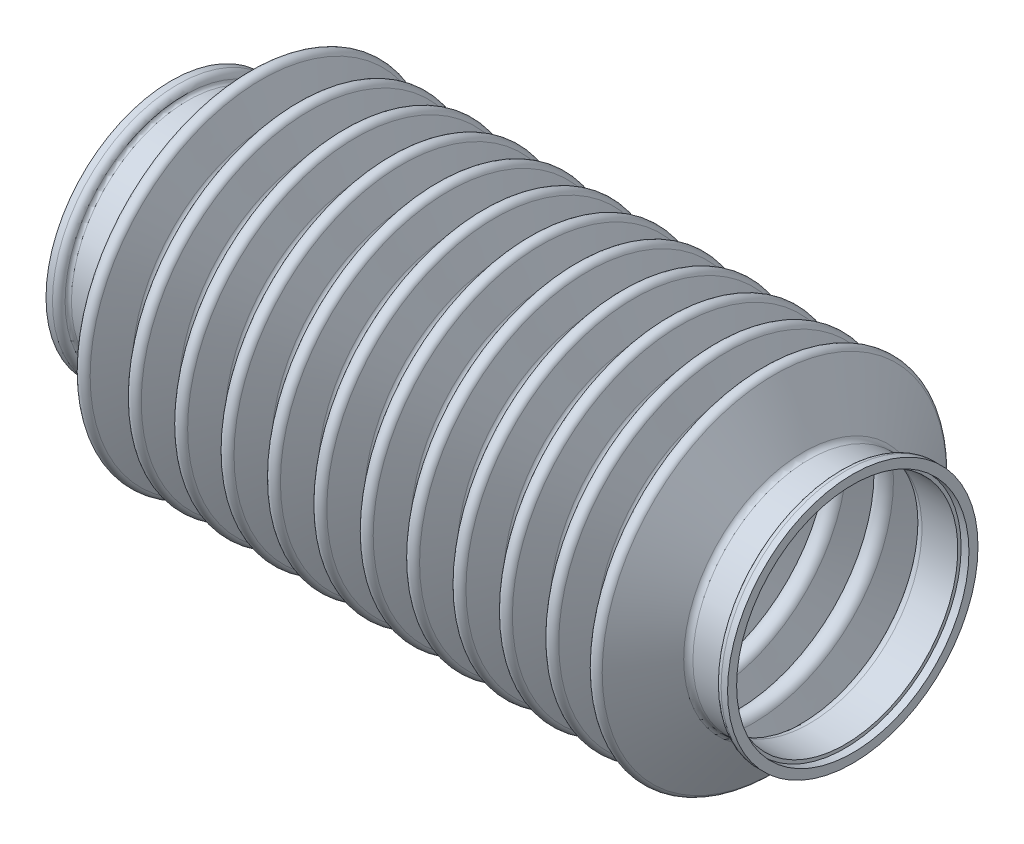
SolidWorks part; units mm, degrees
ref_plane "Alzado" through (0, 0, 0) normal (0, 0, 1) x (1, 0, 0)
ref_plane "Planta" through (0, 0, 0) normal (0, 1, 0) x (1, 0, 0)
ref_plane "Vista lateral" through (0, 0, 0) normal (1, 0, 0) x (0, 0, -1)
sketch "Croquis1" plane through (0, 0, 0) normal (0, 0, 1) x (1, 0, 0)
  line L0 (-66.1214, 37.7921) -> (-66.1214, 35.0586)
  line L1 (-62.1717, 0) -> (100.9562, 0) construction
  line L2 (-61.1836, 35.0586) -> (-52.9347, 35.0586)
  line L3 (-51.1833, 36.0929) -> (-42.4423, 51.9452)
  line L4 (-38.8423, 51.7426) -> (-35.1248, 42.7368)
  line L5 (-24.4274, 50.7375) -> (-21.1248, 42.7368)
  line L6 (-28.1248, 50.7375) -> (-31.4274, 42.7368)
  line L7 (-14.1248, 50.7375) -> (-17.4274, 42.7368)
  line L8 (-10.4274, 50.7375) -> (-7.1248, 42.7368)
  line L9 (-0.1248, 50.7375) -> (-3.4274, 42.7368)
  line L10 (3.5726, 50.7375) -> (6.8752, 42.7368)
  line L11 (13.8752, 50.7375) -> (10.5726, 42.7368)
  line L12 (17.5726, 50.7375) -> (20.8752, 42.7368)
  line L13 (27.8752, 50.7375) -> (24.5726, 42.7368)
  line L14 (31.5726, 50.7375) -> (34.8752, 42.7368)
  line L15 (-64.1717, 37.7921) -> (-66.1214, 37.7921)
  line L16 (-61.1836, 34.0586) -> (-52.9347, 34.0586)
  line L17 (-50.3076, 35.6101) -> (-41.5666, 51.4623)
  line L18 (43.5686, 55.5922) -> (50.7239, 38.2584)
  line L19 (57.8792, 55.5922) -> (50.7239, 38.2584)
  line L20 (43.8792, 55.5922) -> (38.5726, 42.7368)
  line L21 (-39.7666, 51.361) -> (-36.0491, 42.3553)
  line L22 (-27.2004, 50.356) -> (-30.503, 42.3553)
  line L23 (-25.3517, 50.356) -> (-22.0491, 42.3553)
  line L24 (-13.2004, 50.356) -> (-16.503, 42.3553)
  line L25 (-11.3517, 50.356) -> (-8.0491, 42.3553)
  line L26 (0.7996, 50.356) -> (-2.503, 42.3553)
  line L27 (2.6483, 50.356) -> (5.9509, 42.3553)
  line L28 (14.7996, 50.356) -> (11.497, 42.3553)
  line L29 (16.6483, 50.356) -> (19.9509, 42.3553)
  line L30 (28.7996, 50.356) -> (25.497, 42.3553)
  line L31 (30.6483, 50.356) -> (33.9509, 42.3553)
  line L32 (-64.1717, 36.7921) -> (-66.1214, 36.7921) construction
  line L33 (-66.1214, 35.0586) -> (-63.7677, 35.0586)
  line L34 (-63.7677, 35.0586) -> (-63.7677, 34.0586)
  line L35 (-63.7677, 34.0586) -> (-61.1836, 34.0586)
  line L36 (36.7239, 46.4242) -> (36.7239, 34.7599) construction
  line L37 (137.2155, 34.0586) -> (134.6315, 34.0586)
  line L38 (137.2155, 35.0586) -> (137.2155, 34.0586)
  line L39 (139.5692, 35.0586) -> (137.2155, 35.0586)
  line L40 (70.7996, 50.356) -> (67.497, 42.3553)
  line L41 (72.6483, 50.356) -> (75.9509, 42.3553)
  line L42 (84.7996, 50.356) -> (81.497, 42.3553)
  line L43 (86.6483, 50.356) -> (89.9509, 42.3553)
  line L44 (98.7996, 50.356) -> (95.497, 42.3553)
  line L45 (100.6483, 50.356) -> (103.9509, 42.3553)
  line L46 (113.2145, 51.361) -> (109.497, 42.3553)
  line L47 (123.7555, 35.6101) -> (115.0145, 51.4623)
  line L48 (134.6315, 34.0586) -> (126.3826, 34.0586)
  line L49 (137.6196, 37.7921) -> (139.5692, 37.7921)
  line L50 (69.8752, 50.7375) -> (66.5726, 42.7368)
  line L51 (73.5726, 50.7375) -> (76.8752, 42.7368)
  line L52 (83.8752, 50.7375) -> (80.5726, 42.7368)
  line L53 (87.5726, 50.7375) -> (90.8752, 42.7368)
  line L54 (101.5726, 50.7375) -> (104.8752, 42.7368)
  line L55 (97.8752, 50.7375) -> (94.5726, 42.7368)
  line L56 (112.2901, 51.7426) -> (108.5726, 42.7368)
  line L57 (124.6312, 36.0929) -> (115.8902, 51.9452)
  line L58 (134.6315, 35.0586) -> (126.3826, 35.0586)
  line L59 (139.5692, 37.7921) -> (139.5692, 35.0586)
  line L60 (58.6483, 50.356) -> (61.9509, 42.3553)
  line L61 (59.5726, 50.7375) -> (62.8752, 42.7368)
  line L62 (42.7996, 50.356) -> (39.497, 42.3553)
  line L63 (44.6483, 50.356) -> (47.9509, 42.3553)
  line L64 (56.7996, 50.356) -> (53.497, 42.3553)
  line L65 (41.8752, 50.7375) -> (38.5726, 42.7368)
  line L66 (45.5726, 50.7375) -> (48.8752, 42.7368)
  line L67 (55.8752, 50.7375) -> (52.5726, 42.7368)
  arc A0 (-38.8423, 51.7426) -> (-42.4423, 51.9452) centre (-40.6909, 50.9794) ccw
  arc A1 (-31.4274, 42.7368) -> (-35.1248, 42.7368) centre (-33.2761, 43.5) cw
  arc A2 (-24.4274, 50.7375) -> (-28.1248, 50.7375) centre (-26.2761, 49.9744) ccw
  arc A3 (-17.4274, 42.7368) -> (-21.1248, 42.7368) centre (-19.2761, 43.5) cw
  arc A4 (-10.4274, 50.7375) -> (-14.1248, 50.7375) centre (-12.2761, 49.9744) ccw
  arc A5 (-3.4274, 42.7368) -> (-7.1248, 42.7368) centre (-5.2761, 43.5) cw
  arc A6 (3.5726, 50.7375) -> (-0.1248, 50.7375) centre (1.7239, 49.9744) ccw
  arc A7 (10.5726, 42.7368) -> (6.8752, 42.7368) centre (8.7239, 43.5) cw
  arc A8 (17.5726, 50.7375) -> (13.8752, 50.7375) centre (15.7239, 49.9744) ccw
  arc A9 (24.5726, 42.7368) -> (20.8752, 42.7368) centre (22.7239, 43.5) cw
  arc A10 (31.5726, 50.7375) -> (27.8752, 50.7375) centre (29.7239, 49.9744) ccw
  arc A11 (36.7239, 41.5) -> (34.8752, 42.7368) centre (36.7239, 43.5) cw
  arc A12 (-51.1833, 36.0929) -> (-52.9347, 35.0586) centre (-52.9347, 37.0586) cw
  arc A13 (-62.1796, 35.9698) -> (-64.1717, 37.7921) centre (-64.1717, 35.7921) ccw
  arc A14 (-61.1836, 35.0586) -> (-62.1796, 35.9698) centre (-61.1836, 36.0586) cw
  arc A15 (70.7996, 50.356) -> (72.6483, 50.356) centre (71.7239, 49.9744) cw
  arc A16 (75.9509, 42.3553) -> (81.497, 42.3553) centre (78.7239, 43.5) ccw
  arc A17 (-50.3076, 35.6101) -> (-52.9347, 34.0586) centre (-52.9347, 37.0586) cw
  arc A18 (-39.7666, 51.361) -> (-41.5666, 51.4623) centre (-40.6909, 50.9794) ccw
  arc A19 (-30.503, 42.3553) -> (-36.0491, 42.3553) centre (-33.2761, 43.5) cw
  arc A20 (-25.3517, 50.356) -> (-27.2004, 50.356) centre (-26.2761, 49.9744) ccw
  arc A21 (-16.503, 42.3553) -> (-22.0491, 42.3553) centre (-19.2761, 43.5) cw
  arc A22 (-11.3517, 50.356) -> (-13.2004, 50.356) centre (-12.2761, 49.9744) ccw
  arc A23 (-2.503, 42.3553) -> (-8.0491, 42.3553) centre (-5.2761, 43.5) cw
  arc A24 (2.6483, 50.356) -> (0.7996, 50.356) centre (1.7239, 49.9744) ccw
  arc A25 (11.497, 42.3553) -> (5.9509, 42.3553) centre (8.7239, 43.5) cw
  arc A26 (16.6483, 50.356) -> (14.7996, 50.356) centre (15.7239, 49.9744) ccw
  arc A27 (25.497, 42.3553) -> (19.9509, 42.3553) centre (22.7239, 43.5) cw
  arc A28 (30.6483, 50.356) -> (28.7996, 50.356) centre (29.7239, 49.9744) ccw
  arc A29 (36.7239, 40.5) -> (33.9509, 42.3553) centre (36.7239, 43.5) cw
  arc A30 (-61.1836, 34.0586) -> (-63.1757, 35.881) centre (-61.1836, 36.0586) cw construction
  arc A31 (-63.1757, 35.881) -> (-64.1717, 36.7921) centre (-64.1717, 35.7921) ccw construction
  arc A32 (84.7996, 50.356) -> (86.6483, 50.356) centre (85.7239, 49.9744) cw
  arc A33 (89.9509, 42.3553) -> (95.497, 42.3553) centre (92.7239, 43.5) ccw
  arc A34 (98.7996, 50.356) -> (100.6483, 50.356) centre (99.7239, 49.9744) cw
  arc A35 (103.9509, 42.3553) -> (109.497, 42.3553) centre (106.7239, 43.5) ccw
  arc A36 (113.2145, 51.361) -> (115.0145, 51.4623) centre (114.1388, 50.9794) cw
  arc A37 (123.7555, 35.6101) -> (126.3826, 34.0586) centre (126.3826, 37.0586) ccw
  arc A38 (134.6315, 35.0586) -> (135.6275, 35.9698) centre (134.6315, 36.0586) ccw
  arc A39 (135.6275, 35.9698) -> (137.6196, 37.7921) centre (137.6196, 35.7921) cw
  arc A40 (124.6312, 36.0929) -> (126.3826, 35.0586) centre (126.3826, 37.0586) ccw
  arc A41 (69.8752, 50.7375) -> (73.5726, 50.7375) centre (71.7239, 49.9744) cw
  arc A42 (76.8752, 42.7368) -> (80.5726, 42.7368) centre (78.7239, 43.5) ccw
  arc A43 (83.8752, 50.7375) -> (87.5726, 50.7375) centre (85.7239, 49.9744) cw
  arc A44 (90.8752, 42.7368) -> (94.5726, 42.7368) centre (92.7239, 43.5) ccw
  arc A45 (97.8752, 50.7375) -> (101.5726, 50.7375) centre (99.7239, 49.9744) cw
  arc A46 (104.8752, 42.7368) -> (108.5726, 42.7368) centre (106.7239, 43.5) ccw
  arc A47 (112.2901, 51.7426) -> (115.8902, 51.9452) centre (114.1388, 50.9794) cw
  arc A48 (56.7996, 50.356) -> (58.6483, 50.356) centre (57.7239, 49.9744) cw
  arc A49 (61.9509, 42.3553) -> (67.497, 42.3553) centre (64.7239, 43.5) ccw
  arc A50 (55.8752, 50.7375) -> (59.5726, 50.7375) centre (57.7239, 49.9744) cw
  arc A51 (62.8752, 42.7368) -> (66.5726, 42.7368) centre (64.7239, 43.5) ccw
  arc A52 (42.7996, 50.356) -> (44.6483, 50.356) centre (43.7239, 49.9744) cw
  arc A53 (41.8752, 50.7375) -> (45.5726, 50.7375) centre (43.7239, 49.9744) cw
  arc A54 (36.7239, 40.5) -> (39.497, 42.3553) centre (36.7239, 43.5) ccw
  arc A55 (47.9509, 42.3553) -> (53.497, 42.3553) centre (50.7239, 43.5) ccw
  arc A56 (36.7239, 41.5) -> (38.5726, 42.7368) centre (36.7239, 43.5) ccw
  arc A57 (48.8752, 42.7368) -> (52.5726, 42.7368) centre (50.7239, 43.5) ccw
  dimension "D1" = 2
  dimension "D2" = 2
  dimension "D3" = 2
  dimension "D4" = 1
  dimension "D5" = 1
revolve "Revolución1" add sketch "Croquis1" angle 360 about L1
